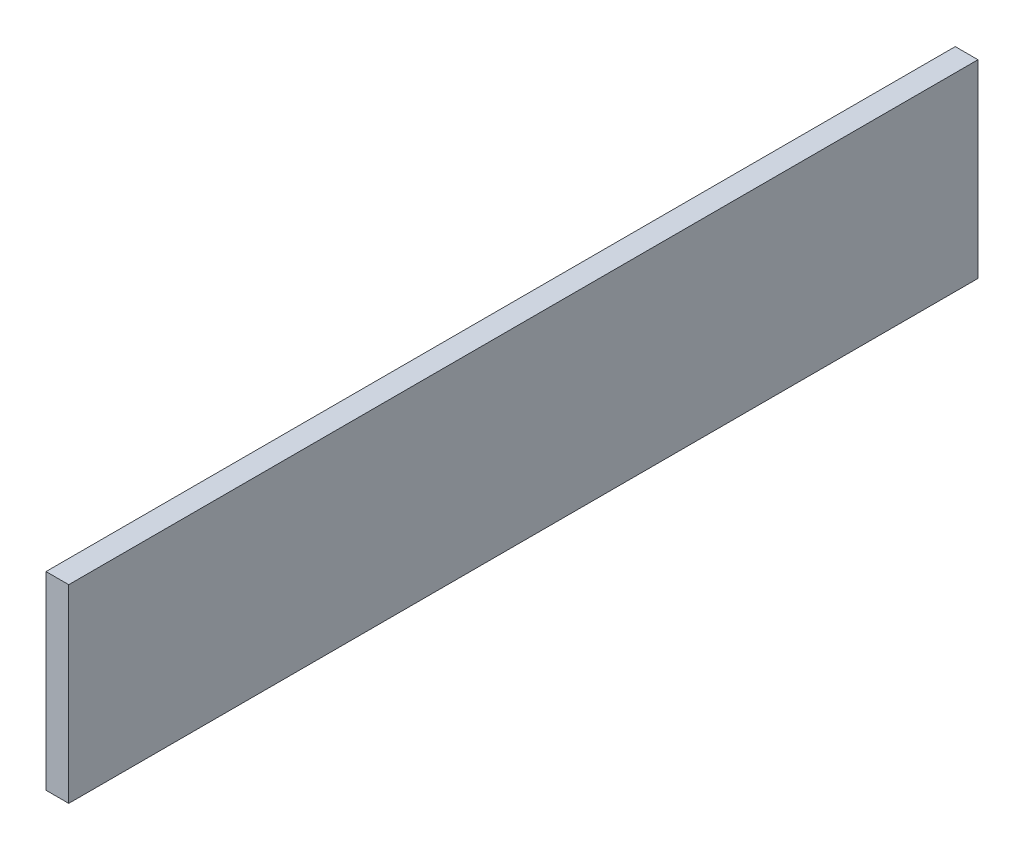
SolidWorks part; units mm, degrees
ref_plane "Plan de face" through (0, 0, 0) normal (0, 0, 1) x (1, 0, 0)
ref_plane "Plan de dessus" through (0, 0, 0) normal (0, 1, 0) x (1, 0, 0)
ref_plane "Plan de droite" through (0, 0, 0) normal (1, 0, 0) x (0, 0, -1)
sketch "Esquisse1" plane through (0, 0, 0) normal (0, 0, 1) x (1, 0, 0)
  line L1 (1.5, 120) -> (-1.5, 120)
  line L2 (1.5, 120) -> (1.5, 95)
  line L3 (1.5, 95) -> (-1.5, 95)
  line L4 (-1.5, 120) -> (-1.5, 95)
extrude "Boss.-Extru.1" add sketch "Esquisse1" against normal blind 110 and the other way blind 10
